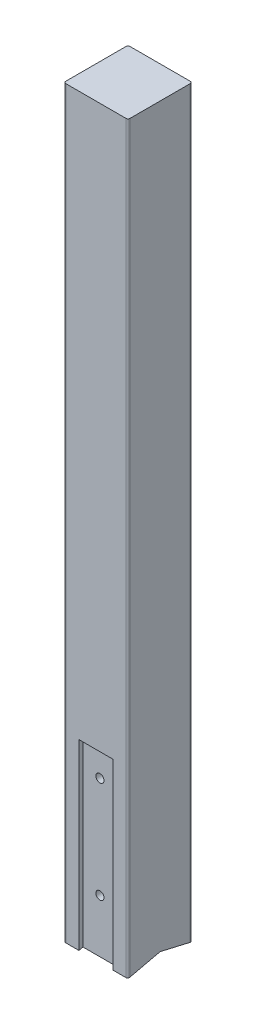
SolidWorks part; units mm, degrees
ref_plane "Front Plane" through (0, 0, 0) normal (0, 0, 1) x (1, 0, 0)
ref_plane "Top Plane" through (0, 0, 0) normal (0, 1, 0) x (1, 0, 0)
ref_plane "Right Plane" through (0, 0, 0) normal (1, 0, 0) x (0, 0, -1)
sketch "Layout tvärsnitt" plane through (0, 0, 0) normal (0, 1, 0) x (1, 0, 0)
  line L0 (0, -47.5) -> (0, 47.5) construction
  line L1 (-47.5, 47.5) -> (47.5, 47.5)
  line L2 (-47.5, 47.5) -> (-47.5, -47.5)
  line L3 (-47.5, -47.5) -> (47.5, -47.5)
  line L4 (47.5, 47.5) -> (47.5, -47.5)
  dimension "D1" = 95
sketch "Sketch slits" plane through (0, 0, 0) normal (0, 1, 0) x (1, 0, 0)
  line L0 (47.5, 47.5) -> (47.5, -47.5) construction
  line L1 (-47.5, -25) -> (47.5, -25)
  line L2 (-47.5, -25) -> (-47.5, -34)
  line L3 (-47.5, -34) -> (47.5, -34)
  line L4 (47.5, -25) -> (47.5, -34)
  line L5 (-47.5, 0) -> (47.5, 0) construction
  line L6 (47.5, -29.5) -> (-47.5, -29.5) construction
  line L7 (-47.5, 47.5) -> (-47.5, -47.5) construction
  line L8 (-47.5, 25) -> (-47.5, 34)
  line L9 (-47.5, 34) -> (47.5, 34)
  line L10 (47.5, 25) -> (47.5, 34)
  line L11 (-47.5, 25) -> (47.5, 25)
  dimension "D1" = 9
  dimension "D2" = 25
sketch "Sketch slitshöjd och skruvhål" plane through (0, 0, 0) normal (0, 0, 1) x (1, 0, 0)
  line L0 (0, 0) -> (0, 270) construction
  circle A3 centre (0, 80) radius 6 construction
  circle A4 centre (0, 230) radius 6 construction
  circle A6 centre (0, 80) radius 6
  circle A7 centre (0, 230) radius 6
  dimension "D2" = 40
  dimension "D1" = 270
  dimension "D3" = 80
sketch "Sketch3" plane through (0, 0, 0) normal (0, 1, 0) x (1, 0, 0)
  line L0 (47.5, 47.5) -> (47.5, -47.5) construction
  line L1 (-47.5, -47.5) -> (47.5, -47.5) construction
  line L2 (-47.5, 47.5) -> (47.5, 47.5) construction
  line L3 (-47.5, 47.5) -> (-47.5, -47.5) construction
  line L4 (47.5, 47.5) -> (47.5, -47.5)
  line L5 (-47.5, -47.5) -> (47.5, -47.5)
  line L6 (-47.5, 47.5) -> (47.5, 47.5)
  line L7 (-47.5, 47.5) -> (-47.5, -47.5)
extrude "Extrude längd" add sketch "Sketch3" along normal blind 1100
sketch "Sketch4" plane through (0, 0, 0) normal (0, 1, 0) x (1, 0, 0)
  line L2 (-47.5, -34) -> (47.5, -34) construction
  line L3 (-47.5, -25) -> (47.5, -25) construction
  line L6 (-47.5, -34) -> (47.5, -34)
  line L7 (-47.5, -25) -> (47.5, -25)
  line L8 (-47.5, 25) -> (47.5, 25) construction
  line L9 (-47.5, 34) -> (47.5, 34) construction
  line L11 (47.5, 47.5) -> (47.5, -47.5) construction
  line L13 (-47.5, 47.5) -> (-47.5, -47.5) construction
  line L14 (-47.5, 25) -> (47.5, 25)
  line L15 (-47.5, 34) -> (47.5, 34)
  line L17 (47.5, 34) -> (47.5, 25)
  line L19 (-47.5, 34) -> (-47.5, 25)
  line L20 (-47.5, -25) -> (-47.5, -34)
  line L21 (47.5, -25) -> (47.5, -34)
extrude "Cut slits" cut sketch "Sketch4" along normal up to vertex
sketch "Sketch5" plane through (0, 0, 0) normal (0, 0, 1) x (1, 0, 0)
  circle A3 centre (0, 230) radius 6 construction
  circle A4 centre (0, 80) radius 6 construction
  circle A5 centre (0, 230) radius 6
  circle A6 centre (0, 80) radius 6
extrude "Cut skruvhål" cut sketch "Sketch5" against normal up to next and the other way up to next
sketch "Sketch6" plane through (0, 0, 0) normal (1, 0, 0) x (0, 0, -1)
  line L1 (0, 0) -> (0, 270) construction
  line L2 (0, 11) -> (-47.5, 0)
  line L4 (0, 0) -> (0, 11) construction
  line L5 (47.5, 0) -> (0, 11)
  dimension "D1" = 11
extrude "Cut lutande botten" cut sketch "Sketch6" against normal through all and the other way through all
sketch "Sketch7" plane through (0, 0, 0) normal (0, 1, 0) x (1, 0, 0)
  circle A0 centre (0, 0) radius 32.5
  dimension "D1" = 65
extrude "Cut urtag rörfot" cut sketch "Sketch7" along normal blind 10
fillet "Fillet kanter" radius 3 4 edges at (47.5, 550, -47.5) (47.5, 550, 47.5) (-47.5, 550, 47.5) (-47.5, 550, -47.5)
sketch "Sketch8" plane through (0, 0, 47.5) normal (0, 1, 0) x (1, 0, 0)
  line L0 (0, 0) -> (0, 47.5) construction
  line L1 (-25, 0) -> (25, 0)
  line L2 (-25, 0) -> (-25, 6)
  line L3 (-25, 6) -> (25, 6)
  line L4 (25, 0) -> (25, 6)
  line L5 (0, -15.75) -> (0, 110.75) construction
  line L9 (-47.5, 0) -> (47.5, 0) construction
  line L11 (0, 89) -> (0, 95) construction
  line L12 (-25, 95) -> (25, 95)
  line L13 (-25, 95) -> (-25, 89)
  line L14 (-25, 89) -> (25, 89)
  line L15 (25, 95) -> (25, 89)
  line L16 (-47.5, 95) -> (47.5, 95) construction
  line L17 (0, 0) -> (0, 95) construction
  dimension "D1" = 50
  dimension "D2" = 6
extrude "Cut urtag plattstål" cut sketch "Sketch8" along normal up to vertex (270 mm away)
